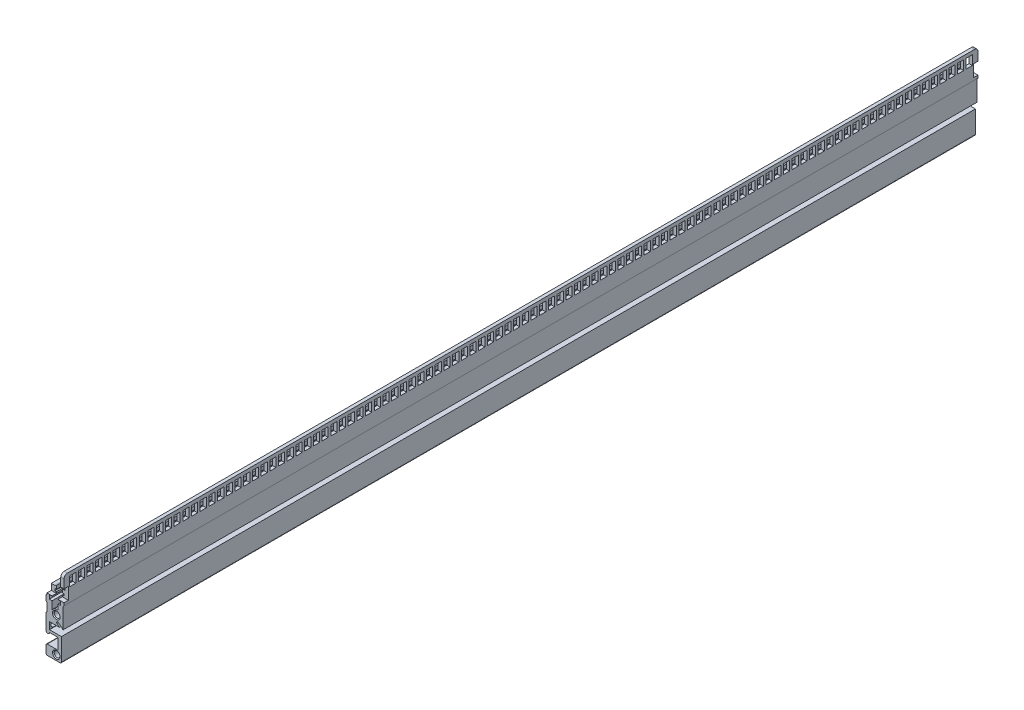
SolidWorks part; units mm, degrees
ref_plane "前视基准面" through (0, 0, 0) normal (0, 0, 1) x (1, 0, 0)
ref_plane "上视基准面" through (0, 0, 0) normal (0, 1, 0) x (1, 0, 0)
ref_plane "右视基准面" through (0, 0, 0) normal (1, 0, 0) x (0, 0, -1)
sketch "草图1" plane through (0, 0, 0) normal (0, 0, 1) x (1, 0, 0)
  line L0 (2.6, 12.5) -> (2.6, 22.5)
  line L1 (0.95, 12.5) -> (2.6, 12.5)
  line L2 (2.6, 22.5) -> (4.5, 22.5)
  line L3 (0.95, 10.55) -> (0.95, 12.5)
  line L4 (4.5, 22.5) -> (4.5, 6.95)
  line L5 (1.85, 10.55) -> (0.95, 10.55)
  line L6 (4, 6.45) -> (4.5, 6.95)
  line L7 (1.85, 9.35) -> (1.85, 10.55)
  line L8 (4, 6.45) -> (4, -5.4458)
  line L9 (0.95, 9.35) -> (1.85, 9.35)
  line L10 (1.2224, -3.1152) -> (4, -5.4458)
  line L11 (0.95, 8.35) -> (0.95, 9.35)
  line L12 (2.55, 8.35) -> (0.95, 8.35)
  line L13 (0.4511, -4.0344) -> (1.8998, -5.25)
  line L14 (2.55, 6.05) -> (2.55, 8.35)
  line L15 (-4, -5.25) -> (1.8998, -5.25)
  line L16 (0.95, 6.05) -> (2.55, 6.05)
  line L17 (-4, -9.35) -> (-4, -5.25)
  line L18 (0.95, 2.9172) -> (0.95, 6.05)
  line L19 (-4, -9.35) -> (3, -9.35)
  line L20 (3, -9.35) -> (3, -22.2)
  line L21 (-2.45, 6.05) -> (-2.45, 1.3077)
  line L22 (-4.05, 6.05) -> (-2.45, 6.05)
  line L23 (2.2, -23) -> (-5.2, -23)
  line L24 (-4.05, 8.35) -> (-4.05, 6.05)
  line L25 (-2.45, 8.35) -> (-4.05, 8.35)
  line L26 (-6, -22.2) -> (-6, -18.05)
  line L27 (-2.45, 9.35) -> (-2.45, 8.35)
  line L28 (-3.35, 9.35) -> (-2.45, 9.35)
  line L29 (-5.2, -17.25) -> (1, -17.25)
  line L30 (-3.35, 10.55) -> (-3.35, 9.35)
  line L31 (1, -10.75) -> (1, -17.25)
  line L32 (-2.45, 10.55) -> (-3.35, 10.55)
  line L33 (-4, -10.75) -> (1, -10.75)
  line L34 (-2.45, 12.5) -> (-2.45, 10.55)
  line L35 (-2.45, 12.5) -> (-3, 12.5)
  line L36 (-6, -10.75) -> (-6, -1.6)
  line L37 (-3, 12.5) -> (-3, 12.1)
  line L38 (-6, -1.6) -> (-5.5501, -1.1002)
  line L39 (-3, 12.1) -> (-5.45, 12.1)
  line L40 (-5.5499, 3.8998) -> (-5.5501, -1.1002)
  line L41 (-5.45, 12.1) -> (-5.45, 7.7)
  line L42 (-5.5499, 3.8998) -> (-6, 4.4)
  line L43 (-5.45, 7.7) -> (-5.7, 7.7)
  line L44 (-6, 4.4) -> (-6, 7.4)
  line L45 (-6, 7.4) -> (-5.7, 7.7)
  circle A0 centre (0, 0) radius 1.7
  circle A1 centre (0, -20) radius 1.7
  arc A2 (1.2224, -3.1152) -> (0.4511, -4.0344) centre (0.8368, -3.5748) ccw
  arc A3 (0.95, 2.9172) -> (-2.45, 1.3077) centre (0.25, 0) ccw
  arc A4 (2.2, -23) -> (3, -22.2) centre (2.2, -22.2) ccw
  arc A5 (-6, -22.2) -> (-5.2, -23) centre (-5.2, -22.2) ccw
  arc A6 (-5.2, -17.25) -> (-6, -18.05) centre (-5.2, -18.05) ccw
  arc A7 (-6, -10.75) -> (-4, -10.75) centre (-5, -10.75) ccw
extrude "凸台-拉伸1" add sketch "草图1" against normal blind 533.4
fillet "圆角1" radius 2 2 edges at (3.55, 22.5, -533.4) (3.55, 22.5, 0)
sketch "草图2" plane through (4.5, 0, 0) normal (1, 0, 0) x (0, 0, -1)
  line L0 (8.36, 20.45) -> (11.96, 20.45)
  line L1 (3.28, 20.45) -> (6.88, 20.45)
  line L2 (3.28, 20.45) -> (3.28, 14.95)
  line L3 (3.28, 14.95) -> (6.88, 14.95)
  line L4 (6.88, 20.45) -> (6.88, 14.95)
  line L5 (5.08, 20.45) -> (5.08, 14.95) construction
  line L6 (3.28, 17.7) -> (6.88, 17.7) construction
  line L7 (531.4, 22.5) -> (2, 22.5) construction
  line L8 (0, 20.5) -> (0, 12.5) construction
  line L9 (8.36, 20.45) -> (8.36, 14.95)
  line L10 (8.36, 14.95) -> (11.96, 14.95)
  line L11 (11.96, 20.45) -> (11.96, 14.95)
  line L12 (10.16, 20.45) -> (10.16, 14.95) construction
  line L13 (8.36, 17.7) -> (11.96, 17.7) construction
  line L14 (13.44, 20.45) -> (17.04, 20.45)
  line L15 (13.44, 20.45) -> (13.44, 14.95)
  line L16 (13.44, 14.95) -> (17.04, 14.95)
  line L17 (17.04, 20.45) -> (17.04, 14.95)
  line L18 (15.24, 20.45) -> (15.24, 14.95) construction
  line L19 (13.44, 17.7) -> (17.04, 17.7) construction
  line L20 (18.52, 20.45) -> (22.12, 20.45)
  line L21 (18.52, 20.45) -> (18.52, 14.95)
  line L22 (18.52, 14.95) -> (22.12, 14.95)
  line L23 (22.12, 20.45) -> (22.12, 14.95)
  line L24 (20.32, 20.45) -> (20.32, 14.95) construction
  line L25 (18.52, 17.7) -> (22.12, 17.7) construction
  line L26 (23.6, 20.45) -> (27.2, 20.45)
  line L27 (23.6, 20.45) -> (23.6, 14.95)
  line L28 (23.6, 14.95) -> (27.2, 14.95)
  line L29 (27.2, 20.45) -> (27.2, 14.95)
  line L30 (25.4, 20.45) -> (25.4, 14.95) construction
  line L31 (23.6, 17.7) -> (27.2, 17.7) construction
  line L32 (28.68, 20.45) -> (32.28, 20.45)
  line L33 (28.68, 20.45) -> (28.68, 14.95)
  line L34 (28.68, 14.95) -> (32.28, 14.95)
  line L35 (32.28, 20.45) -> (32.28, 14.95)
  line L36 (30.48, 20.45) -> (30.48, 14.95) construction
  line L37 (28.68, 17.7) -> (32.28, 17.7) construction
  line L38 (33.76, 20.45) -> (37.36, 20.45)
  line L39 (33.76, 20.45) -> (33.76, 14.95)
  line L40 (33.76, 14.95) -> (37.36, 14.95)
  line L41 (37.36, 20.45) -> (37.36, 14.95)
  line L42 (35.56, 20.45) -> (35.56, 14.95) construction
  line L43 (33.76, 17.7) -> (37.36, 17.7) construction
  line L44 (38.84, 20.45) -> (42.44, 20.45)
  line L45 (38.84, 20.45) -> (38.84, 14.95)
  line L46 (38.84, 14.95) -> (42.44, 14.95)
  line L47 (42.44, 20.45) -> (42.44, 14.95)
  line L48 (40.64, 20.45) -> (40.64, 14.95) construction
  line L49 (38.84, 17.7) -> (42.44, 17.7) construction
  line L50 (43.92, 20.45) -> (47.52, 20.45)
  line L51 (43.92, 20.45) -> (43.92, 14.95)
  line L52 (43.92, 14.95) -> (47.52, 14.95)
  line L53 (47.52, 20.45) -> (47.52, 14.95)
  line L54 (45.72, 20.45) -> (45.72, 14.95) construction
  line L55 (43.92, 17.7) -> (47.52, 17.7) construction
  line L56 (49, 20.45) -> (52.6, 20.45)
  line L57 (49, 20.45) -> (49, 14.95)
  line L58 (49, 14.95) -> (52.6, 14.95)
  line L59 (52.6, 20.45) -> (52.6, 14.95)
  line L60 (50.8, 20.45) -> (50.8, 14.95) construction
  line L61 (49, 17.7) -> (52.6, 17.7) construction
  line L62 (54.08, 20.45) -> (57.68, 20.45)
  line L63 (54.08, 20.45) -> (54.08, 14.95)
  line L64 (54.08, 14.95) -> (57.68, 14.95)
  line L65 (57.68, 20.45) -> (57.68, 14.95)
  line L66 (55.88, 20.45) -> (55.88, 14.95) construction
  line L67 (54.08, 17.7) -> (57.68, 17.7) construction
  line L68 (59.16, 20.45) -> (62.76, 20.45)
  line L69 (59.16, 20.45) -> (59.16, 14.95)
  line L70 (59.16, 14.95) -> (62.76, 14.95)
  line L71 (62.76, 20.45) -> (62.76, 14.95)
  line L72 (60.96, 20.45) -> (60.96, 14.95) construction
  line L73 (59.16, 17.7) -> (62.76, 17.7) construction
  line L74 (64.24, 20.45) -> (67.84, 20.45)
  line L75 (64.24, 20.45) -> (64.24, 14.95)
  line L76 (64.24, 14.95) -> (67.84, 14.95)
  line L77 (67.84, 20.45) -> (67.84, 14.95)
  line L78 (66.04, 20.45) -> (66.04, 14.95) construction
  line L79 (64.24, 17.7) -> (67.84, 17.7) construction
  line L80 (69.32, 20.45) -> (72.92, 20.45)
  line L81 (69.32, 20.45) -> (69.32, 14.95)
  line L82 (69.32, 14.95) -> (72.92, 14.95)
  line L83 (72.92, 20.45) -> (72.92, 14.95)
  line L84 (71.12, 20.45) -> (71.12, 14.95) construction
  line L85 (69.32, 17.7) -> (72.92, 17.7) construction
  line L86 (74.4, 20.45) -> (78, 20.45)
  line L87 (74.4, 20.45) -> (74.4, 14.95)
  line L88 (74.4, 14.95) -> (78, 14.95)
  line L89 (78, 20.45) -> (78, 14.95)
  line L90 (76.2, 20.45) -> (76.2, 14.95) construction
  line L91 (74.4, 17.7) -> (78, 17.7) construction
  line L92 (79.48, 20.45) -> (83.08, 20.45)
  line L93 (79.48, 20.45) -> (79.48, 14.95)
  line L94 (79.48, 14.95) -> (83.08, 14.95)
  line L95 (83.08, 20.45) -> (83.08, 14.95)
  line L96 (81.28, 20.45) -> (81.28, 14.95) construction
  line L97 (79.48, 17.7) -> (83.08, 17.7) construction
  line L98 (84.56, 20.45) -> (88.16, 20.45)
  line L99 (84.56, 20.45) -> (84.56, 14.95)
  line L100 (84.56, 14.95) -> (88.16, 14.95)
  line L101 (88.16, 20.45) -> (88.16, 14.95)
  line L102 (86.36, 20.45) -> (86.36, 14.95) construction
  line L103 (84.56, 17.7) -> (88.16, 17.7) construction
  line L104 (89.64, 20.45) -> (93.24, 20.45)
  line L105 (89.64, 20.45) -> (89.64, 14.95)
  line L106 (89.64, 14.95) -> (93.24, 14.95)
  line L107 (93.24, 20.45) -> (93.24, 14.95)
  line L108 (91.44, 20.45) -> (91.44, 14.95) construction
  line L109 (89.64, 17.7) -> (93.24, 17.7) construction
  line L110 (94.72, 20.45) -> (98.32, 20.45)
  line L111 (94.72, 20.45) -> (94.72, 14.95)
  line L112 (94.72, 14.95) -> (98.32, 14.95)
  line L113 (98.32, 20.45) -> (98.32, 14.95)
  line L114 (96.52, 20.45) -> (96.52, 14.95) construction
  line L115 (94.72, 17.7) -> (98.32, 17.7) construction
  line L116 (99.8, 20.45) -> (103.4, 20.45)
  line L117 (99.8, 20.45) -> (99.8, 14.95)
  line L118 (99.8, 14.95) -> (103.4, 14.95)
  line L119 (103.4, 20.45) -> (103.4, 14.95)
  line L120 (101.6, 20.45) -> (101.6, 14.95) construction
  line L121 (99.8, 17.7) -> (103.4, 17.7) construction
  line L122 (104.88, 20.45) -> (108.48, 20.45)
  line L123 (104.88, 20.45) -> (104.88, 14.95)
  line L124 (104.88, 14.95) -> (108.48, 14.95)
  line L125 (108.48, 20.45) -> (108.48, 14.95)
  line L126 (106.68, 20.45) -> (106.68, 14.95) construction
  line L127 (104.88, 17.7) -> (108.48, 17.7) construction
  line L128 (109.96, 20.45) -> (113.56, 20.45)
  line L129 (109.96, 20.45) -> (109.96, 14.95)
  line L130 (109.96, 14.95) -> (113.56, 14.95)
  line L131 (113.56, 20.45) -> (113.56, 14.95)
  line L132 (111.76, 20.45) -> (111.76, 14.95) construction
  line L133 (109.96, 17.7) -> (113.56, 17.7) construction
  line L134 (115.04, 20.45) -> (118.64, 20.45)
  line L135 (115.04, 20.45) -> (115.04, 14.95)
  line L136 (115.04, 14.95) -> (118.64, 14.95)
  line L137 (118.64, 20.45) -> (118.64, 14.95)
  line L138 (116.84, 20.45) -> (116.84, 14.95) construction
  line L139 (115.04, 17.7) -> (118.64, 17.7) construction
  line L140 (120.12, 20.45) -> (123.72, 20.45)
  line L141 (120.12, 20.45) -> (120.12, 14.95)
  line L142 (120.12, 14.95) -> (123.72, 14.95)
  line L143 (123.72, 20.45) -> (123.72, 14.95)
  line L144 (121.92, 20.45) -> (121.92, 14.95) construction
  line L145 (120.12, 17.7) -> (123.72, 17.7) construction
  line L146 (125.2, 20.45) -> (128.8, 20.45)
  line L147 (125.2, 20.45) -> (125.2, 14.95)
  line L148 (125.2, 14.95) -> (128.8, 14.95)
  line L149 (128.8, 20.45) -> (128.8, 14.95)
  line L150 (127, 20.45) -> (127, 14.95) construction
  line L151 (125.2, 17.7) -> (128.8, 17.7) construction
  line L152 (130.28, 20.45) -> (133.88, 20.45)
  line L153 (130.28, 20.45) -> (130.28, 14.95)
  line L154 (130.28, 14.95) -> (133.88, 14.95)
  line L155 (133.88, 20.45) -> (133.88, 14.95)
  line L156 (132.08, 20.45) -> (132.08, 14.95) construction
  line L157 (130.28, 17.7) -> (133.88, 17.7) construction
  line L158 (135.36, 20.45) -> (138.96, 20.45)
  line L159 (135.36, 20.45) -> (135.36, 14.95)
  line L160 (135.36, 14.95) -> (138.96, 14.95)
  line L161 (138.96, 20.45) -> (138.96, 14.95)
  line L162 (137.16, 20.45) -> (137.16, 14.95) construction
  line L163 (135.36, 17.7) -> (138.96, 17.7) construction
  line L164 (140.44, 20.45) -> (144.04, 20.45)
  line L165 (140.44, 20.45) -> (140.44, 14.95)
  line L166 (140.44, 14.95) -> (144.04, 14.95)
  line L167 (144.04, 20.45) -> (144.04, 14.95)
  line L168 (142.24, 20.45) -> (142.24, 14.95) construction
  line L169 (140.44, 17.7) -> (144.04, 17.7) construction
  line L170 (145.52, 20.45) -> (149.12, 20.45)
  line L171 (145.52, 20.45) -> (145.52, 14.95)
  line L172 (145.52, 14.95) -> (149.12, 14.95)
  line L173 (149.12, 20.45) -> (149.12, 14.95)
  line L174 (147.32, 20.45) -> (147.32, 14.95) construction
  line L175 (145.52, 17.7) -> (149.12, 17.7) construction
  line L176 (150.6, 20.45) -> (154.2, 20.45)
  line L177 (150.6, 20.45) -> (150.6, 14.95)
  line L178 (150.6, 14.95) -> (154.2, 14.95)
  line L179 (154.2, 20.45) -> (154.2, 14.95)
  line L180 (152.4, 20.45) -> (152.4, 14.95) construction
  line L181 (150.6, 17.7) -> (154.2, 17.7) construction
  line L182 (155.68, 20.45) -> (159.28, 20.45)
  line L183 (155.68, 20.45) -> (155.68, 14.95)
  line L184 (155.68, 14.95) -> (159.28, 14.95)
  line L185 (159.28, 20.45) -> (159.28, 14.95)
  line L186 (157.48, 20.45) -> (157.48, 14.95) construction
  line L187 (155.68, 17.7) -> (159.28, 17.7) construction
  line L188 (160.76, 20.45) -> (164.36, 20.45)
  line L189 (160.76, 20.45) -> (160.76, 14.95)
  line L190 (160.76, 14.95) -> (164.36, 14.95)
  line L191 (164.36, 20.45) -> (164.36, 14.95)
  line L192 (162.56, 20.45) -> (162.56, 14.95) construction
  line L193 (160.76, 17.7) -> (164.36, 17.7) construction
  line L194 (165.84, 20.45) -> (169.44, 20.45)
  line L195 (165.84, 20.45) -> (165.84, 14.95)
  line L196 (165.84, 14.95) -> (169.44, 14.95)
  line L197 (169.44, 20.45) -> (169.44, 14.95)
  line L198 (167.64, 20.45) -> (167.64, 14.95) construction
  line L199 (165.84, 17.7) -> (169.44, 17.7) construction
  line L200 (170.92, 20.45) -> (174.52, 20.45)
  line L201 (170.92, 20.45) -> (170.92, 14.95)
  line L202 (170.92, 14.95) -> (174.52, 14.95)
  line L203 (174.52, 20.45) -> (174.52, 14.95)
  line L204 (172.72, 20.45) -> (172.72, 14.95) construction
  line L205 (170.92, 17.7) -> (174.52, 17.7) construction
  line L206 (176, 20.45) -> (179.6, 20.45)
  line L207 (176, 20.45) -> (176, 14.95)
  line L208 (176, 14.95) -> (179.6, 14.95)
  line L209 (179.6, 20.45) -> (179.6, 14.95)
  line L210 (177.8, 20.45) -> (177.8, 14.95) construction
  line L211 (176, 17.7) -> (179.6, 17.7) construction
  line L212 (181.08, 20.45) -> (184.68, 20.45)
  line L213 (181.08, 20.45) -> (181.08, 14.95)
  line L214 (181.08, 14.95) -> (184.68, 14.95)
  line L215 (184.68, 20.45) -> (184.68, 14.95)
  line L216 (182.88, 20.45) -> (182.88, 14.95) construction
  line L217 (181.08, 17.7) -> (184.68, 17.7) construction
  line L218 (186.16, 20.45) -> (189.76, 20.45)
  line L219 (186.16, 20.45) -> (186.16, 14.95)
  line L220 (186.16, 14.95) -> (189.76, 14.95)
  line L221 (189.76, 20.45) -> (189.76, 14.95)
  line L222 (187.96, 20.45) -> (187.96, 14.95) construction
  line L223 (186.16, 17.7) -> (189.76, 17.7) construction
  line L224 (191.24, 20.45) -> (194.84, 20.45)
  line L225 (191.24, 20.45) -> (191.24, 14.95)
  line L226 (191.24, 14.95) -> (194.84, 14.95)
  line L227 (194.84, 20.45) -> (194.84, 14.95)
  line L228 (193.04, 20.45) -> (193.04, 14.95) construction
  line L229 (191.24, 17.7) -> (194.84, 17.7) construction
  line L230 (196.32, 20.45) -> (199.92, 20.45)
  line L231 (196.32, 20.45) -> (196.32, 14.95)
  line L232 (196.32, 14.95) -> (199.92, 14.95)
  line L233 (199.92, 20.45) -> (199.92, 14.95)
  line L234 (198.12, 20.45) -> (198.12, 14.95) construction
  line L235 (196.32, 17.7) -> (199.92, 17.7) construction
  line L236 (201.4, 20.45) -> (205, 20.45)
  line L237 (201.4, 20.45) -> (201.4, 14.95)
  line L238 (201.4, 14.95) -> (205, 14.95)
  line L239 (205, 20.45) -> (205, 14.95)
  line L240 (203.2, 20.45) -> (203.2, 14.95) construction
  line L241 (201.4, 17.7) -> (205, 17.7) construction
  line L242 (206.48, 20.45) -> (210.08, 20.45)
  line L243 (206.48, 20.45) -> (206.48, 14.95)
  line L244 (206.48, 14.95) -> (210.08, 14.95)
  line L245 (210.08, 20.45) -> (210.08, 14.95)
  line L246 (208.28, 20.45) -> (208.28, 14.95) construction
  line L247 (206.48, 17.7) -> (210.08, 17.7) construction
  line L248 (211.56, 20.45) -> (215.16, 20.45)
  line L249 (211.56, 20.45) -> (211.56, 14.95)
  line L250 (211.56, 14.95) -> (215.16, 14.95)
  line L251 (215.16, 20.45) -> (215.16, 14.95)
  line L252 (213.36, 20.45) -> (213.36, 14.95) construction
  line L253 (211.56, 17.7) -> (215.16, 17.7) construction
  line L254 (216.64, 20.45) -> (220.24, 20.45)
  line L255 (216.64, 20.45) -> (216.64, 14.95)
  line L256 (216.64, 14.95) -> (220.24, 14.95)
  line L257 (220.24, 20.45) -> (220.24, 14.95)
  line L258 (218.44, 20.45) -> (218.44, 14.95) construction
  line L259 (216.64, 17.7) -> (220.24, 17.7) construction
  line L260 (221.72, 20.45) -> (225.32, 20.45)
  line L261 (221.72, 20.45) -> (221.72, 14.95)
  line L262 (221.72, 14.95) -> (225.32, 14.95)
  line L263 (225.32, 20.45) -> (225.32, 14.95)
  line L264 (223.52, 20.45) -> (223.52, 14.95) construction
  line L265 (221.72, 17.7) -> (225.32, 17.7) construction
  line L266 (226.8, 20.45) -> (230.4, 20.45)
  line L267 (226.8, 20.45) -> (226.8, 14.95)
  line L268 (226.8, 14.95) -> (230.4, 14.95)
  line L269 (230.4, 20.45) -> (230.4, 14.95)
  line L270 (228.6, 20.45) -> (228.6, 14.95) construction
  line L271 (226.8, 17.7) -> (230.4, 17.7) construction
  line L272 (231.88, 20.45) -> (235.48, 20.45)
  line L273 (231.88, 20.45) -> (231.88, 14.95)
  line L274 (231.88, 14.95) -> (235.48, 14.95)
  line L275 (235.48, 20.45) -> (235.48, 14.95)
  line L276 (233.68, 20.45) -> (233.68, 14.95) construction
  line L277 (231.88, 17.7) -> (235.48, 17.7) construction
  line L278 (236.96, 20.45) -> (240.56, 20.45)
  line L279 (236.96, 20.45) -> (236.96, 14.95)
  line L280 (236.96, 14.95) -> (240.56, 14.95)
  line L281 (240.56, 20.45) -> (240.56, 14.95)
  line L282 (238.76, 20.45) -> (238.76, 14.95) construction
  line L283 (236.96, 17.7) -> (240.56, 17.7) construction
  line L284 (242.04, 20.45) -> (245.64, 20.45)
  line L285 (242.04, 20.45) -> (242.04, 14.95)
  line L286 (242.04, 14.95) -> (245.64, 14.95)
  line L287 (245.64, 20.45) -> (245.64, 14.95)
  line L288 (243.84, 20.45) -> (243.84, 14.95) construction
  line L289 (242.04, 17.7) -> (245.64, 17.7) construction
  line L290 (247.12, 20.45) -> (250.72, 20.45)
  line L291 (247.12, 20.45) -> (247.12, 14.95)
  line L292 (247.12, 14.95) -> (250.72, 14.95)
  line L293 (250.72, 20.45) -> (250.72, 14.95)
  line L294 (248.92, 20.45) -> (248.92, 14.95) construction
  line L295 (247.12, 17.7) -> (250.72, 17.7) construction
  line L296 (252.2, 20.45) -> (255.8, 20.45)
  line L297 (252.2, 20.45) -> (252.2, 14.95)
  line L298 (252.2, 14.95) -> (255.8, 14.95)
  line L299 (255.8, 20.45) -> (255.8, 14.95)
  line L300 (254, 20.45) -> (254, 14.95) construction
  line L301 (252.2, 17.7) -> (255.8, 17.7) construction
  line L302 (257.28, 20.45) -> (260.88, 20.45)
  line L303 (257.28, 20.45) -> (257.28, 14.95)
  line L304 (257.28, 14.95) -> (260.88, 14.95)
  line L305 (260.88, 20.45) -> (260.88, 14.95)
  line L306 (259.08, 20.45) -> (259.08, 14.95) construction
  line L307 (257.28, 17.7) -> (260.88, 17.7) construction
  line L308 (262.36, 20.45) -> (265.96, 20.45)
  line L309 (262.36, 20.45) -> (262.36, 14.95)
  line L310 (262.36, 14.95) -> (265.96, 14.95)
  line L311 (265.96, 20.45) -> (265.96, 14.95)
  line L312 (264.16, 20.45) -> (264.16, 14.95) construction
  line L313 (262.36, 17.7) -> (265.96, 17.7) construction
  line L314 (267.44, 20.45) -> (271.04, 20.45)
  line L315 (267.44, 20.45) -> (267.44, 14.95)
  line L316 (267.44, 14.95) -> (271.04, 14.95)
  line L317 (271.04, 20.45) -> (271.04, 14.95)
  line L318 (269.24, 20.45) -> (269.24, 14.95) construction
  line L319 (267.44, 17.7) -> (271.04, 17.7) construction
  line L320 (272.52, 20.45) -> (276.12, 20.45)
  line L321 (272.52, 20.45) -> (272.52, 14.95)
  line L322 (272.52, 14.95) -> (276.12, 14.95)
  line L323 (276.12, 20.45) -> (276.12, 14.95)
  line L324 (274.32, 20.45) -> (274.32, 14.95) construction
  line L325 (272.52, 17.7) -> (276.12, 17.7) construction
  line L326 (277.6, 20.45) -> (281.2, 20.45)
  line L327 (277.6, 20.45) -> (277.6, 14.95)
  line L328 (277.6, 14.95) -> (281.2, 14.95)
  line L329 (281.2, 20.45) -> (281.2, 14.95)
  line L330 (279.4, 20.45) -> (279.4, 14.95) construction
  line L331 (277.6, 17.7) -> (281.2, 17.7) construction
  line L332 (282.68, 20.45) -> (286.28, 20.45)
  line L333 (282.68, 20.45) -> (282.68, 14.95)
  line L334 (282.68, 14.95) -> (286.28, 14.95)
  line L335 (286.28, 20.45) -> (286.28, 14.95)
  line L336 (284.48, 20.45) -> (284.48, 14.95) construction
  line L337 (282.68, 17.7) -> (286.28, 17.7) construction
  line L338 (287.76, 20.45) -> (291.36, 20.45)
  line L339 (287.76, 20.45) -> (287.76, 14.95)
  line L340 (287.76, 14.95) -> (291.36, 14.95)
  line L341 (291.36, 20.45) -> (291.36, 14.95)
  line L342 (289.56, 20.45) -> (289.56, 14.95) construction
  line L343 (287.76, 17.7) -> (291.36, 17.7) construction
  line L344 (292.84, 20.45) -> (296.44, 20.45)
  line L345 (292.84, 20.45) -> (292.84, 14.95)
  line L346 (292.84, 14.95) -> (296.44, 14.95)
  line L347 (296.44, 20.45) -> (296.44, 14.95)
  line L348 (294.64, 20.45) -> (294.64, 14.95) construction
  line L349 (292.84, 17.7) -> (296.44, 17.7) construction
  line L350 (297.92, 20.45) -> (301.52, 20.45)
  line L351 (297.92, 20.45) -> (297.92, 14.95)
  line L352 (297.92, 14.95) -> (301.52, 14.95)
  line L353 (301.52, 20.45) -> (301.52, 14.95)
  line L354 (299.72, 20.45) -> (299.72, 14.95) construction
  line L355 (297.92, 17.7) -> (301.52, 17.7) construction
  line L356 (303, 20.45) -> (306.6, 20.45)
  line L357 (303, 20.45) -> (303, 14.95)
  line L358 (303, 14.95) -> (306.6, 14.95)
  line L359 (306.6, 20.45) -> (306.6, 14.95)
  line L360 (304.8, 20.45) -> (304.8, 14.95) construction
  line L361 (303, 17.7) -> (306.6, 17.7) construction
  line L362 (308.08, 20.45) -> (311.68, 20.45)
  line L363 (308.08, 20.45) -> (308.08, 14.95)
  line L364 (308.08, 14.95) -> (311.68, 14.95)
  line L365 (311.68, 20.45) -> (311.68, 14.95)
  line L366 (309.88, 20.45) -> (309.88, 14.95) construction
  line L367 (308.08, 17.7) -> (311.68, 17.7) construction
  line L368 (313.16, 20.45) -> (316.76, 20.45)
  line L369 (313.16, 20.45) -> (313.16, 14.95)
  line L370 (313.16, 14.95) -> (316.76, 14.95)
  line L371 (316.76, 20.45) -> (316.76, 14.95)
  line L372 (314.96, 20.45) -> (314.96, 14.95) construction
  line L373 (313.16, 17.7) -> (316.76, 17.7) construction
  line L374 (318.24, 20.45) -> (321.84, 20.45)
  line L375 (318.24, 20.45) -> (318.24, 14.95)
  line L376 (318.24, 14.95) -> (321.84, 14.95)
  line L377 (321.84, 20.45) -> (321.84, 14.95)
  line L378 (320.04, 20.45) -> (320.04, 14.95) construction
  line L379 (318.24, 17.7) -> (321.84, 17.7) construction
  line L380 (323.32, 20.45) -> (326.92, 20.45)
  line L381 (323.32, 20.45) -> (323.32, 14.95)
  line L382 (323.32, 14.95) -> (326.92, 14.95)
  line L383 (326.92, 20.45) -> (326.92, 14.95)
  line L384 (325.12, 20.45) -> (325.12, 14.95) construction
  line L385 (323.32, 17.7) -> (326.92, 17.7) construction
  line L386 (328.4, 20.45) -> (332, 20.45)
  line L387 (328.4, 20.45) -> (328.4, 14.95)
  line L388 (328.4, 14.95) -> (332, 14.95)
  line L389 (332, 20.45) -> (332, 14.95)
  line L390 (330.2, 20.45) -> (330.2, 14.95) construction
  line L391 (328.4, 17.7) -> (332, 17.7) construction
  line L392 (333.48, 20.45) -> (337.08, 20.45)
  line L393 (333.48, 20.45) -> (333.48, 14.95)
  line L394 (333.48, 14.95) -> (337.08, 14.95)
  line L395 (337.08, 20.45) -> (337.08, 14.95)
  line L396 (335.28, 20.45) -> (335.28, 14.95) construction
  line L397 (333.48, 17.7) -> (337.08, 17.7) construction
  line L398 (338.56, 20.45) -> (342.16, 20.45)
  line L399 (338.56, 20.45) -> (338.56, 14.95)
  line L400 (338.56, 14.95) -> (342.16, 14.95)
  line L401 (342.16, 20.45) -> (342.16, 14.95)
  line L402 (340.36, 20.45) -> (340.36, 14.95) construction
  line L403 (338.56, 17.7) -> (342.16, 17.7) construction
  line L404 (343.64, 20.45) -> (347.24, 20.45)
  line L405 (343.64, 20.45) -> (343.64, 14.95)
  line L406 (343.64, 14.95) -> (347.24, 14.95)
  line L407 (347.24, 20.45) -> (347.24, 14.95)
  line L408 (345.44, 20.45) -> (345.44, 14.95) construction
  line L409 (343.64, 17.7) -> (347.24, 17.7) construction
  line L410 (348.72, 20.45) -> (352.32, 20.45)
  line L411 (348.72, 20.45) -> (348.72, 14.95)
  line L412 (348.72, 14.95) -> (352.32, 14.95)
  line L413 (352.32, 20.45) -> (352.32, 14.95)
  line L414 (350.52, 20.45) -> (350.52, 14.95) construction
  line L415 (348.72, 17.7) -> (352.32, 17.7) construction
  line L416 (353.8, 20.45) -> (357.4, 20.45)
  line L417 (353.8, 20.45) -> (353.8, 14.95)
  line L418 (353.8, 14.95) -> (357.4, 14.95)
  line L419 (357.4, 20.45) -> (357.4, 14.95)
  line L420 (355.6, 20.45) -> (355.6, 14.95) construction
  line L421 (353.8, 17.7) -> (357.4, 17.7) construction
  line L422 (358.88, 20.45) -> (362.48, 20.45)
  line L423 (358.88, 20.45) -> (358.88, 14.95)
  line L424 (358.88, 14.95) -> (362.48, 14.95)
  line L425 (362.48, 20.45) -> (362.48, 14.95)
  line L426 (360.68, 20.45) -> (360.68, 14.95) construction
  line L427 (358.88, 17.7) -> (362.48, 17.7) construction
  line L428 (363.96, 20.45) -> (367.56, 20.45)
  line L429 (363.96, 20.45) -> (363.96, 14.95)
  line L430 (363.96, 14.95) -> (367.56, 14.95)
  line L431 (367.56, 20.45) -> (367.56, 14.95)
  line L432 (365.76, 20.45) -> (365.76, 14.95) construction
  line L433 (363.96, 17.7) -> (367.56, 17.7) construction
  line L434 (369.04, 20.45) -> (372.64, 20.45)
  line L435 (369.04, 20.45) -> (369.04, 14.95)
  line L436 (369.04, 14.95) -> (372.64, 14.95)
  line L437 (372.64, 20.45) -> (372.64, 14.95)
  line L438 (370.84, 20.45) -> (370.84, 14.95) construction
  line L439 (369.04, 17.7) -> (372.64, 17.7) construction
  line L440 (374.12, 20.45) -> (377.72, 20.45)
  line L441 (374.12, 20.45) -> (374.12, 14.95)
  line L442 (374.12, 14.95) -> (377.72, 14.95)
  line L443 (377.72, 20.45) -> (377.72, 14.95)
  line L444 (375.92, 20.45) -> (375.92, 14.95) construction
  line L445 (374.12, 17.7) -> (377.72, 17.7) construction
  line L446 (379.2, 20.45) -> (382.8, 20.45)
  line L447 (379.2, 20.45) -> (379.2, 14.95)
  line L448 (379.2, 14.95) -> (382.8, 14.95)
  line L449 (382.8, 20.45) -> (382.8, 14.95)
  line L450 (381, 20.45) -> (381, 14.95) construction
  line L451 (379.2, 17.7) -> (382.8, 17.7) construction
  line L452 (384.28, 20.45) -> (387.88, 20.45)
  line L453 (384.28, 20.45) -> (384.28, 14.95)
  line L454 (384.28, 14.95) -> (387.88, 14.95)
  line L455 (387.88, 20.45) -> (387.88, 14.95)
  line L456 (386.08, 20.45) -> (386.08, 14.95) construction
  line L457 (384.28, 17.7) -> (387.88, 17.7) construction
  line L458 (389.36, 20.45) -> (392.96, 20.45)
  line L459 (389.36, 20.45) -> (389.36, 14.95)
  line L460 (389.36, 14.95) -> (392.96, 14.95)
  line L461 (392.96, 20.45) -> (392.96, 14.95)
  line L462 (391.16, 20.45) -> (391.16, 14.95) construction
  line L463 (389.36, 17.7) -> (392.96, 17.7) construction
  line L464 (394.44, 20.45) -> (398.04, 20.45)
  line L465 (394.44, 20.45) -> (394.44, 14.95)
  line L466 (394.44, 14.95) -> (398.04, 14.95)
  line L467 (398.04, 20.45) -> (398.04, 14.95)
  line L468 (396.24, 20.45) -> (396.24, 14.95) construction
  line L469 (394.44, 17.7) -> (398.04, 17.7) construction
  line L470 (399.52, 20.45) -> (403.12, 20.45)
  line L471 (399.52, 20.45) -> (399.52, 14.95)
  line L472 (399.52, 14.95) -> (403.12, 14.95)
  line L473 (403.12, 20.45) -> (403.12, 14.95)
  line L474 (401.32, 20.45) -> (401.32, 14.95) construction
  line L475 (399.52, 17.7) -> (403.12, 17.7) construction
  line L476 (404.6, 20.45) -> (408.2, 20.45)
  line L477 (404.6, 20.45) -> (404.6, 14.95)
  line L478 (404.6, 14.95) -> (408.2, 14.95)
  line L479 (408.2, 20.45) -> (408.2, 14.95)
  line L480 (406.4, 20.45) -> (406.4, 14.95) construction
  line L481 (404.6, 17.7) -> (408.2, 17.7) construction
  line L482 (409.68, 20.45) -> (413.28, 20.45)
  line L483 (409.68, 20.45) -> (409.68, 14.95)
  line L484 (409.68, 14.95) -> (413.28, 14.95)
  line L485 (413.28, 20.45) -> (413.28, 14.95)
  line L486 (411.48, 20.45) -> (411.48, 14.95) construction
  line L487 (409.68, 17.7) -> (413.28, 17.7) construction
  line L488 (414.76, 20.45) -> (418.36, 20.45)
  line L489 (414.76, 20.45) -> (414.76, 14.95)
  line L490 (414.76, 14.95) -> (418.36, 14.95)
  line L491 (418.36, 20.45) -> (418.36, 14.95)
  line L492 (416.56, 20.45) -> (416.56, 14.95) construction
  line L493 (414.76, 17.7) -> (418.36, 17.7) construction
  line L494 (419.84, 20.45) -> (423.44, 20.45)
  line L495 (419.84, 20.45) -> (419.84, 14.95)
  line L496 (419.84, 14.95) -> (423.44, 14.95)
  line L497 (423.44, 20.45) -> (423.44, 14.95)
  line L498 (421.64, 20.45) -> (421.64, 14.95) construction
  line L499 (419.84, 17.7) -> (423.44, 17.7) construction
  line L500 (424.92, 20.45) -> (428.52, 20.45)
  line L501 (424.92, 20.45) -> (424.92, 14.95)
  line L502 (424.92, 14.95) -> (428.52, 14.95)
  line L503 (428.52, 20.45) -> (428.52, 14.95)
  line L504 (426.72, 20.45) -> (426.72, 14.95) construction
  line L505 (424.92, 17.7) -> (428.52, 17.7) construction
  line L506 (430, 20.45) -> (433.6, 20.45)
  line L507 (430, 20.45) -> (430, 14.95)
  line L508 (430, 14.95) -> (433.6, 14.95)
  line L509 (433.6, 20.45) -> (433.6, 14.95)
  line L510 (431.8, 20.45) -> (431.8, 14.95) construction
  line L511 (430, 17.7) -> (433.6, 17.7) construction
  line L512 (435.08, 20.45) -> (438.68, 20.45)
  line L513 (435.08, 20.45) -> (435.08, 14.95)
  line L514 (435.08, 14.95) -> (438.68, 14.95)
  line L515 (438.68, 20.45) -> (438.68, 14.95)
  line L516 (436.88, 20.45) -> (436.88, 14.95) construction
  line L517 (435.08, 17.7) -> (438.68, 17.7) construction
  line L518 (440.16, 20.45) -> (443.76, 20.45)
  line L519 (440.16, 20.45) -> (440.16, 14.95)
  line L520 (440.16, 14.95) -> (443.76, 14.95)
  line L521 (443.76, 20.45) -> (443.76, 14.95)
  line L522 (441.96, 20.45) -> (441.96, 14.95) construction
  line L523 (440.16, 17.7) -> (443.76, 17.7) construction
  line L524 (445.24, 20.45) -> (448.84, 20.45)
  line L525 (445.24, 20.45) -> (445.24, 14.95)
  line L526 (445.24, 14.95) -> (448.84, 14.95)
  line L527 (448.84, 20.45) -> (448.84, 14.95)
  line L528 (447.04, 20.45) -> (447.04, 14.95) construction
  line L529 (445.24, 17.7) -> (448.84, 17.7) construction
  line L530 (450.32, 20.45) -> (453.92, 20.45)
  line L531 (450.32, 20.45) -> (450.32, 14.95)
  line L532 (450.32, 14.95) -> (453.92, 14.95)
  line L533 (453.92, 20.45) -> (453.92, 14.95)
  line L534 (452.12, 20.45) -> (452.12, 14.95) construction
  line L535 (450.32, 17.7) -> (453.92, 17.7) construction
  line L536 (455.4, 20.45) -> (459, 20.45)
  line L537 (455.4, 20.45) -> (455.4, 14.95)
  line L538 (455.4, 14.95) -> (459, 14.95)
  line L539 (459, 20.45) -> (459, 14.95)
  line L540 (457.2, 20.45) -> (457.2, 14.95) construction
  line L541 (455.4, 17.7) -> (459, 17.7) construction
  line L542 (460.48, 20.45) -> (464.08, 20.45)
  line L543 (460.48, 20.45) -> (460.48, 14.95)
  line L544 (460.48, 14.95) -> (464.08, 14.95)
  line L545 (464.08, 20.45) -> (464.08, 14.95)
  line L546 (462.28, 20.45) -> (462.28, 14.95) construction
  line L547 (460.48, 17.7) -> (464.08, 17.7) construction
  line L548 (465.56, 20.45) -> (469.16, 20.45)
  line L549 (465.56, 20.45) -> (465.56, 14.95)
  line L550 (465.56, 14.95) -> (469.16, 14.95)
  line L551 (469.16, 20.45) -> (469.16, 14.95)
  line L552 (467.36, 20.45) -> (467.36, 14.95) construction
  line L553 (465.56, 17.7) -> (469.16, 17.7) construction
  line L554 (470.64, 20.45) -> (474.24, 20.45)
  line L555 (470.64, 20.45) -> (470.64, 14.95)
  line L556 (470.64, 14.95) -> (474.24, 14.95)
  line L557 (474.24, 20.45) -> (474.24, 14.95)
  line L558 (472.44, 20.45) -> (472.44, 14.95) construction
  line L559 (470.64, 17.7) -> (474.24, 17.7) construction
  line L560 (475.72, 20.45) -> (479.32, 20.45)
  line L561 (475.72, 20.45) -> (475.72, 14.95)
  line L562 (475.72, 14.95) -> (479.32, 14.95)
  line L563 (479.32, 20.45) -> (479.32, 14.95)
  line L564 (477.52, 20.45) -> (477.52, 14.95) construction
  line L565 (475.72, 17.7) -> (479.32, 17.7) construction
  line L566 (480.8, 20.45) -> (484.4, 20.45)
  line L567 (480.8, 20.45) -> (480.8, 14.95)
  line L568 (480.8, 14.95) -> (484.4, 14.95)
  line L569 (484.4, 20.45) -> (484.4, 14.95)
  line L570 (482.6, 20.45) -> (482.6, 14.95) construction
  line L571 (480.8, 17.7) -> (484.4, 17.7) construction
  line L572 (485.88, 20.45) -> (489.48, 20.45)
  line L573 (485.88, 20.45) -> (485.88, 14.95)
  line L574 (485.88, 14.95) -> (489.48, 14.95)
  line L575 (489.48, 20.45) -> (489.48, 14.95)
  line L576 (487.68, 20.45) -> (487.68, 14.95) construction
  line L577 (485.88, 17.7) -> (489.48, 17.7) construction
  line L578 (490.96, 20.45) -> (494.56, 20.45)
  line L579 (490.96, 20.45) -> (490.96, 14.95)
  line L580 (490.96, 14.95) -> (494.56, 14.95)
  line L581 (494.56, 20.45) -> (494.56, 14.95)
  line L582 (492.76, 20.45) -> (492.76, 14.95) construction
  line L583 (490.96, 17.7) -> (494.56, 17.7) construction
  line L584 (496.04, 20.45) -> (499.64, 20.45)
  line L585 (496.04, 20.45) -> (496.04, 14.95)
  line L586 (496.04, 14.95) -> (499.64, 14.95)
  line L587 (499.64, 20.45) -> (499.64, 14.95)
  line L588 (497.84, 20.45) -> (497.84, 14.95) construction
  line L589 (496.04, 17.7) -> (499.64, 17.7) construction
  line L590 (501.12, 20.45) -> (504.72, 20.45)
  line L591 (501.12, 20.45) -> (501.12, 14.95)
  line L592 (501.12, 14.95) -> (504.72, 14.95)
  line L593 (504.72, 20.45) -> (504.72, 14.95)
  line L594 (502.92, 20.45) -> (502.92, 14.95) construction
  line L595 (501.12, 17.7) -> (504.72, 17.7) construction
  line L596 (506.2, 20.45) -> (509.8, 20.45)
  line L597 (506.2, 20.45) -> (506.2, 14.95)
  line L598 (506.2, 14.95) -> (509.8, 14.95)
  line L599 (509.8, 20.45) -> (509.8, 14.95)
  line L600 (508, 20.45) -> (508, 14.95) construction
  line L601 (506.2, 17.7) -> (509.8, 17.7) construction
  line L602 (511.28, 20.45) -> (514.88, 20.45)
  line L603 (511.28, 20.45) -> (511.28, 14.95)
  line L604 (511.28, 14.95) -> (514.88, 14.95)
  line L605 (514.88, 20.45) -> (514.88, 14.95)
  line L606 (513.08, 20.45) -> (513.08, 14.95) construction
  line L607 (511.28, 17.7) -> (514.88, 17.7) construction
  line L608 (516.36, 20.45) -> (519.96, 20.45)
  line L609 (516.36, 20.45) -> (516.36, 14.95)
  line L610 (516.36, 14.95) -> (519.96, 14.95)
  line L611 (519.96, 20.45) -> (519.96, 14.95)
  line L612 (518.16, 20.45) -> (518.16, 14.95) construction
  line L613 (516.36, 17.7) -> (519.96, 17.7) construction
  line L614 (521.44, 20.45) -> (525.04, 20.45)
  line L615 (521.44, 20.45) -> (521.44, 14.95)
  line L616 (521.44, 14.95) -> (525.04, 14.95)
  line L617 (525.04, 20.45) -> (525.04, 14.95)
  line L618 (523.24, 20.45) -> (523.24, 14.95) construction
  line L619 (521.44, 17.7) -> (525.04, 17.7) construction
  line L620 (526.52, 20.45) -> (530.12, 20.45)
  line L621 (526.52, 20.45) -> (526.52, 14.95)
  line L622 (526.52, 14.95) -> (530.12, 14.95)
  line L623 (530.12, 20.45) -> (530.12, 14.95)
  line L624 (528.32, 20.45) -> (528.32, 14.95) construction
  line L625 (526.52, 17.7) -> (530.12, 17.7) construction
extrude "切除-拉伸1" cut sketch "草图2" against normal up to next (1.9 mm away)
sketch "草图3" plane through (4.5, 0, 0) normal (1, 0, 0) x (0, 0, -1)
  line L0 (531.4, 22.5) -> (2, 22.5) construction
  line L1 (0, 15.5) -> (2.54, 15.5)
  line L2 (0, 15.5) -> (0, 8.5)
  line L3 (0, 8.5) -> (2.54, 8.5)
  line L4 (2.54, 15.5) -> (2.54, 8.5)
  line L6 (0, 6.95) -> (0, 20.5) construction
  dimension "D1" = 7
  dimension "D2" = 2.54
  dimension "D3" = 7
  dimension "D4" = 0
extrude "切除-拉伸2" cut sketch "草图3" against normal through all
ref_plane "基准面2" through (0, 0, -266.7) normal (0, 0, 1) x (1, 0, 0)
mirror "镜向1" about plane through (0, 0, -266.7) normal (0, 0, 1) of "切除-拉伸2"
sketch "草图4" plane through (-6, 0, 0) normal (-1, 0, 0) x (0, 0, 1)
  line L0 (-533.4, -1.6) -> (-533.4, -10.75) construction
  line L1 (-533.4, -9.35) -> (0, -9.35) construction
  circle A0 centre (-530.86, -7.45) radius 1.65
  circle A1 centre (-525.78, -7.45) radius 1.65
  circle A2 centre (-520.7, -7.45) radius 1.65
  circle A3 centre (-515.62, -7.45) radius 1.65
  circle A4 centre (-510.54, -7.45) radius 1.65
  circle A5 centre (-505.46, -7.45) radius 1.65
  circle A6 centre (-500.38, -7.45) radius 1.65
  circle A7 centre (-495.3, -7.45) radius 1.65
  circle A8 centre (-490.22, -7.45) radius 1.65
  circle A9 centre (-485.14, -7.45) radius 1.65
  circle A10 centre (-480.06, -7.45) radius 1.65
  circle A11 centre (-474.98, -7.45) radius 1.65
  circle A12 centre (-469.9, -7.45) radius 1.65
  circle A13 centre (-464.82, -7.45) radius 1.65
  circle A14 centre (-459.74, -7.45) radius 1.65
  circle A15 centre (-454.66, -7.45) radius 1.65
  circle A16 centre (-449.58, -7.45) radius 1.65
  circle A17 centre (-444.5, -7.45) radius 1.65
  circle A18 centre (-439.42, -7.45) radius 1.65
  circle A19 centre (-434.34, -7.45) radius 1.65
  circle A20 centre (-429.26, -7.45) radius 1.65
  circle A21 centre (-424.18, -7.45) radius 1.65
  circle A22 centre (-419.1, -7.45) radius 1.65
  circle A23 centre (-414.02, -7.45) radius 1.65
  circle A24 centre (-408.94, -7.45) radius 1.65
  circle A25 centre (-403.86, -7.45) radius 1.65
  circle A26 centre (-398.78, -7.45) radius 1.65
  circle A27 centre (-393.7, -7.45) radius 1.65
  circle A28 centre (-388.62, -7.45) radius 1.65
  circle A29 centre (-383.54, -7.45) radius 1.65
  circle A30 centre (-378.46, -7.45) radius 1.65
  circle A31 centre (-373.38, -7.45) radius 1.65
  circle A32 centre (-368.3, -7.45) radius 1.65
  circle A33 centre (-363.22, -7.45) radius 1.65
  circle A34 centre (-358.14, -7.45) radius 1.65
  circle A35 centre (-353.06, -7.45) radius 1.65
  circle A36 centre (-347.98, -7.45) radius 1.65
  circle A37 centre (-342.9, -7.45) radius 1.65
  circle A38 centre (-337.82, -7.45) radius 1.65
  circle A39 centre (-332.74, -7.45) radius 1.65
  circle A40 centre (-327.66, -7.45) radius 1.65
  circle A41 centre (-322.58, -7.45) radius 1.65
  circle A42 centre (-317.5, -7.45) radius 1.65
  circle A43 centre (-312.42, -7.45) radius 1.65
  circle A44 centre (-307.34, -7.45) radius 1.65
  circle A45 centre (-302.26, -7.45) radius 1.65
  circle A46 centre (-297.18, -7.45) radius 1.65
  circle A47 centre (-292.1, -7.45) radius 1.65
  circle A48 centre (-287.02, -7.45) radius 1.65
  circle A49 centre (-281.94, -7.45) radius 1.65
  circle A50 centre (-276.86, -7.45) radius 1.65
  circle A51 centre (-271.78, -7.45) radius 1.65
  circle A52 centre (-266.7, -7.45) radius 1.65
  circle A53 centre (-261.62, -7.45) radius 1.65
  circle A54 centre (-256.54, -7.45) radius 1.65
  circle A55 centre (-251.46, -7.45) radius 1.65
  circle A56 centre (-246.38, -7.45) radius 1.65
  circle A57 centre (-241.3, -7.45) radius 1.65
  circle A58 centre (-236.22, -7.45) radius 1.65
  circle A59 centre (-231.14, -7.45) radius 1.65
  circle A60 centre (-226.06, -7.45) radius 1.65
  circle A61 centre (-220.98, -7.45) radius 1.65
  circle A62 centre (-215.9, -7.45) radius 1.65
  circle A63 centre (-210.82, -7.45) radius 1.65
  circle A64 centre (-205.74, -7.45) radius 1.65
  circle A65 centre (-200.66, -7.45) radius 1.65
  circle A66 centre (-195.58, -7.45) radius 1.65
  circle A67 centre (-190.5, -7.45) radius 1.65
  circle A68 centre (-185.42, -7.45) radius 1.65
  circle A69 centre (-180.34, -7.45) radius 1.65
  circle A70 centre (-175.26, -7.45) radius 1.65
  circle A71 centre (-170.18, -7.45) radius 1.65
  circle A72 centre (-165.1, -7.45) radius 1.65
  circle A73 centre (-160.02, -7.45) radius 1.65
  circle A74 centre (-154.94, -7.45) radius 1.65
  circle A75 centre (-149.86, -7.45) radius 1.65
  circle A76 centre (-144.78, -7.45) radius 1.65
  circle A77 centre (-139.7, -7.45) radius 1.65
  circle A78 centre (-134.62, -7.45) radius 1.65
  circle A79 centre (-129.54, -7.45) radius 1.65
  circle A80 centre (-124.46, -7.45) radius 1.65
  circle A81 centre (-119.38, -7.45) radius 1.65
  circle A82 centre (-114.3, -7.45) radius 1.65
  circle A83 centre (-109.22, -7.45) radius 1.65
  circle A84 centre (-104.14, -7.45) radius 1.65
  circle A85 centre (-99.06, -7.45) radius 1.65
  circle A86 centre (-93.98, -7.45) radius 1.65
  circle A87 centre (-88.9, -7.45) radius 1.65
  circle A88 centre (-83.82, -7.45) radius 1.65
  circle A89 centre (-78.74, -7.45) radius 1.65
  circle A90 centre (-73.66, -7.45) radius 1.65
  circle A91 centre (-68.58, -7.45) radius 1.65
  circle A92 centre (-63.5, -7.45) radius 1.65
  circle A93 centre (-58.42, -7.45) radius 1.65
  circle A94 centre (-53.34, -7.45) radius 1.65
  circle A95 centre (-48.26, -7.45) radius 1.65
  circle A96 centre (-43.18, -7.45) radius 1.65
  circle A97 centre (-38.1, -7.45) radius 1.65
  circle A98 centre (-33.02, -7.45) radius 1.65
  circle A99 centre (-27.94, -7.45) radius 1.65
  circle A100 centre (-22.86, -7.45) radius 1.65
  circle A101 centre (-17.78, -7.45) radius 1.65
  circle A102 centre (-12.7, -7.45) radius 1.65
  circle A103 centre (-7.62, -7.45) radius 1.65
  circle A104 centre (-2.54, -7.45) radius 1.65
extrude "切除-拉伸3" cut sketch "草图4" against normal up to next (2 mm away)
chamfer "倒角1" distance 0.5 angle 45 3 edges at (1.7, -20, 0) (1.7, 0, 0) (1.7, 0, -533.4)
chamfer "倒角2" distance 0.5 angle 45 1 edges at (1.7, -20, -533.4)
equation "\"D4@草图4\"=\"D1@凸台-拉伸1\"/5.08"
equation "\"D5@草图2\"=\"D1@凸台-拉伸1\"/5.08-1"
